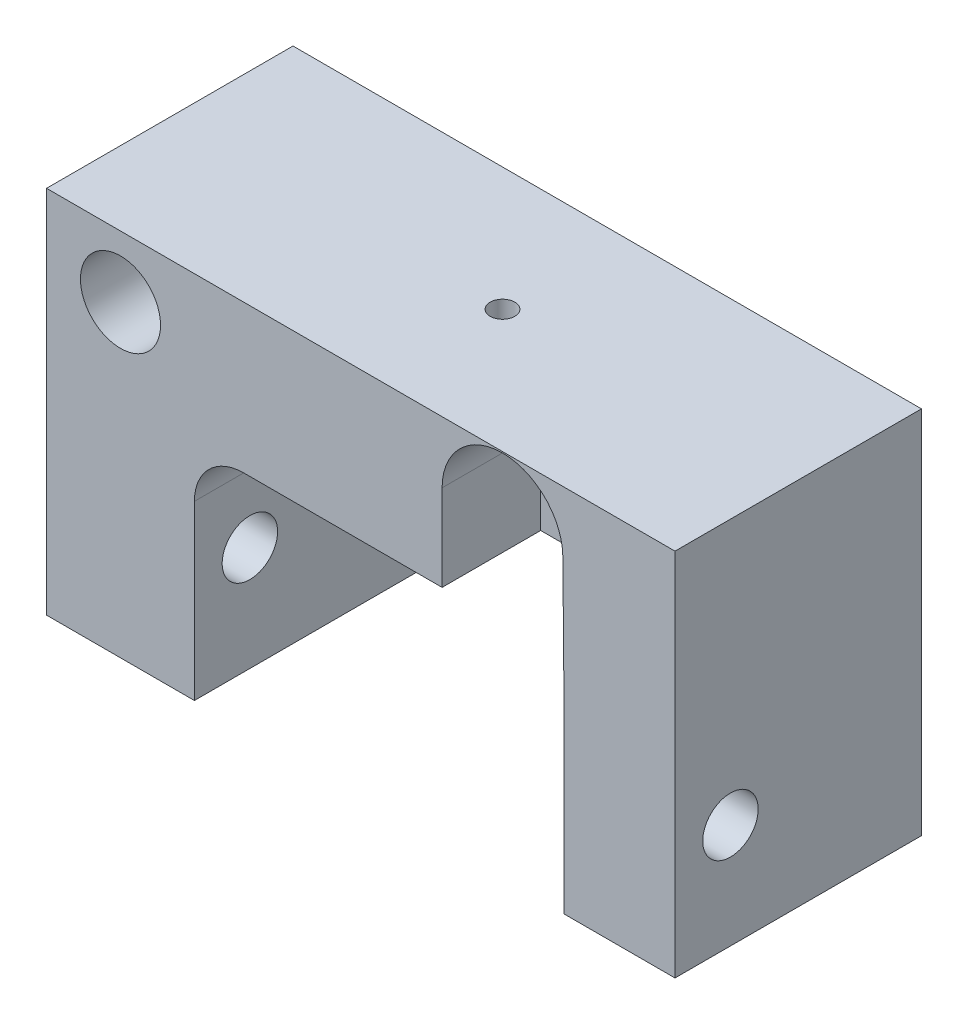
SolidWorks part; units mm, degrees
ref_plane "Alzado" through (0, 0, 0) normal (0, 0, 1) x (1, 0, 0)
ref_plane "Planta" through (0, 0, 0) normal (0, 1, 0) x (1, 0, 0)
ref_plane "Vista lateral" through (0, 0, 0) normal (1, 0, 0) x (0, 0, -1)
sketch "Croquis1" plane through (0, 0, 0) normal (0, 0, 1) x (1, 0, 0)
  line L0 (-25.5, -15) -> (-13.5, -15)
  line L1 (25.5, -15) -> (16.5, -15)
  line L2 (-25.5, -15) -> (-25.5, 15)
  line L3 (-25.5, 15) -> (25.5, 15)
  line L4 (25.5, -15) -> (25.5, 15)
  line L5 (-25.5, -15) -> (25.5, 15) construction
  line L6 (-25.5, 15) -> (25.5, -15) construction
  line L7 (16.5, -15) -> (16.5, -1)
  line L8 (-13.5, -15) -> (-13.5, -1)
  line L9 (-9.5, 3) -> (12.5, 3)
  arc A0 (16.5, -1) -> (12.5, 3) centre (12.5, -1) ccw
  arc A1 (-9.5, 3) -> (-13.5, -1) centre (-9.5, -1) ccw
  point P0 (0, 0)
  dimension "D3" = 4
  dimension "D1" = 51
  dimension "D2" = 30
extrude "Saliente-Extruir1" add sketch "Croquis1" along normal blind 20 contours L3 L4 L1 L7 A0 L9 A1 L8 L0 L2
sketch "Croquis2" plane through (0, 15, 0) normal (0, 1, 0) x (1, 0, 0)
  line L0 (-25.5, -20) -> (-25.5, 0) construction
  circle A0 centre (1.5, -10) radius 1
  dimension "D1" = 27
extrude "Cortar-Extruir1" cut sketch "Croquis2" against normal up to next
sketch "Croquis3" plane through (25.5, 0, 0) normal (1, 0, 0) x (0, 0, -1)
  line L0 (-20, -15) -> (0, -15) construction
  line L1 (-20, -15) -> (-20, 15) construction
  circle A0 centre (-15.5, -6.5) radius 2.25
  dimension "D1" = 8.5
  dimension "D2" = 4.5
extrude "Cortar-Extruir2" cut sketch "Croquis3" against normal through all
sketch "Croquis4" plane through (0, 0, 0) normal (0, 0, -1) x (-1, 0, 0)
  line L1 (25.5, 15) -> (-25.5, 15) construction
  line L2 (-25.5, -15) -> (-25.5, 15) construction
  circle A0 centre (-11.5, 10) radius 1.6
  circle A1 centre (19.5, 10) radius 1.6
  dimension "D1" = 31
  dimension "D2" = 14
  dimension "D3" = 5
  dimension "D4" = 5
extrude "Cortar-Extruir3" cut sketch "Croquis4" against normal blind 20
sketch "Croquis5" plane through (0, 0, 0) normal (0, 0, -1) x (-1, 0, 0)
  circle A0 centre (3.431, -6.7634) radius 12.3695
extrude "Cortar-Extruir4" cut sketch "Croquis5" against normal blind 2.2
sketch "Croquis6" plane through (0, 0, 20) normal (0, 0, 1) x (1, 0, 0)
  circle A0 centre (-19.5, 10) radius 3.25
extrude "Cortar-Extruir5" cut sketch "Croquis6" against normal blind 6
sketch "Croquis9" plane through (0, 0, 20) normal (0, 0, 1) x (1, 0, 0)
  line L0 (16.3998, 10.0445) -> (16.5, -1)
  line L1 (16.5, -1) -> (6.6, -1)
  line L2 (6.6, -1) -> (6.6, 10)
  arc A0 (16.3998, 10.0445) -> (6.6, 10) centre (11.5, 10) ccw
extrude "Cortar-Extruir7" cut sketch "Croquis9" against normal blind 8
